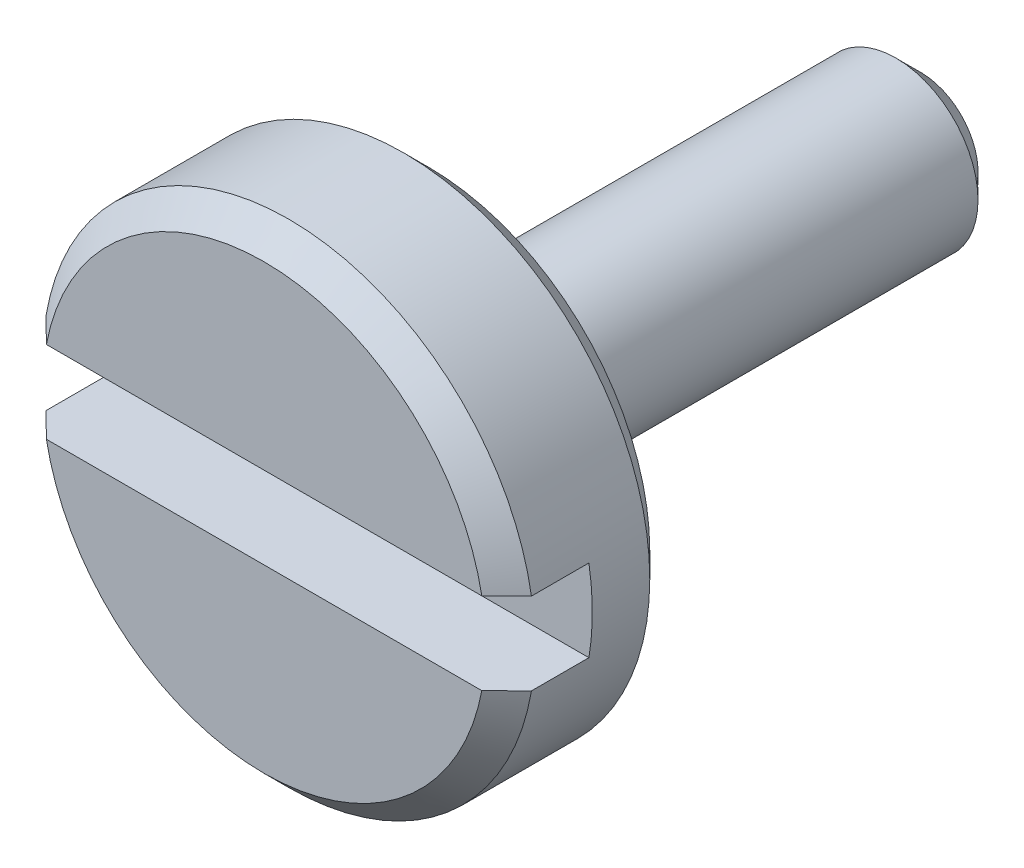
SolidWorks part; units mm, degrees
ref_plane "Plan de face" through (0, 0, 0) normal (0, 0, 1) x (1, 0, 0)
ref_plane "Plan de dessus" through (0, 0, 0) normal (0, 1, 0) x (1, 0, 0)
ref_plane "Plan de droite" through (0, 0, 0) normal (1, 0, 0) x (0, 0, -1)
sketch "Esquisse1" plane through (0, 0, 0) normal (0, 0, 1) x (1, 0, 0)
  circle A0 centre (0, 0) radius 30
  dimension "D1" = 60
extrude "Boss.-Extru.1" add sketch "Esquisse1" along normal blind 20
chamfer "Chanfrein1" distance 3 angle 45 1 edges at (30, 0, 20)
chamfer "Chanfrein2" distance 3 angle 45 1 edges at (30, 0, 0)
sketch "Esquisse2" plane through (0, 0, 20) normal (0, 0, 1) x (1, 0, 0)
  line L0 (0, 27) -> (0, -27) construction
  line L1 (-27, 0) -> (27, 0) construction
  line L2 (-5.1259, 5) -> (-5.1259, 0) construction
  line L3 (-31.8396, 5) -> (34.6983, 5)
  line L4 (-31.8396, 5) -> (-31.8396, -5)
  line L5 (-31.8396, -5) -> (34.6983, -5)
  line L6 (34.6983, 5) -> (34.6983, -5)
  circle A0 centre (0, 0) radius 27 construction
  dimension "D1" = 10
extrude "Enlèv. mat.-Extru.1" cut sketch "Esquisse2" against normal blind 10
sketch "Esquisse4" plane through (0, 0, 0) normal (0, 0, -1) x (-1, 0, 0)
  circle A0 centre (0, 0) radius 10
  dimension "D1" = 20
extrude "Boss.-Extru.2" add sketch "Esquisse4" along normal blind 60
chamfer "Chanfrein3" distance 3 angle 45 1 edges at (-10, 0, -60)
sketch "Esquisse6" plane through (0, 0, 0) normal (0, 1, 0) x (1, 0, 0)
  line L0 (0, 56.8247) -> (-17, 56.8247) construction
  line L1 (-17, 56.123) -> (-17, 44.123) construction
  circle A0 centre (-17, 44.123) radius 10
extrude "Enlèv. mat.-Extru.3" cut sketch "Esquisse6" against normal mid plane 2.5
sketch "Esquisse7" plane through (0, 0, -60) normal (0, 0, -1) x (-1, 0, 0)
  text T0 "E"
extrude "Enlèv. mat.-Extru.4" cut sketch "Esquisse7" against normal blind 1
equation "\"5mmmm\"=2.5"
